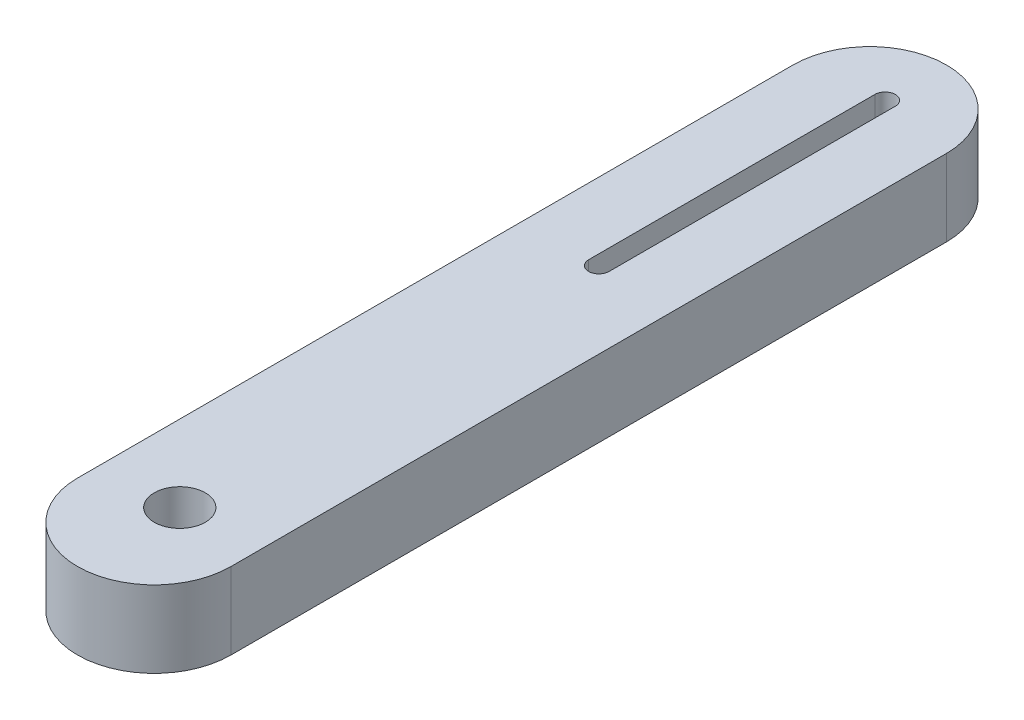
SolidWorks part; units mm, degrees
ref_plane "Front Plane" through (0, 0, 0) normal (0, 0, 1) x (1, 0, 0)
ref_plane "Top Plane" through (0, 0, 0) normal (0, 1, 0) x (1, 0, 0)
ref_plane "Right Plane" through (0, 0, 0) normal (1, 0, 0) x (0, 0, -1)
sketch "Sketch1" plane through (0, 0, 0) normal (0, 0, 1) x (1, 0, 0)
  line L1 (-19.05, -9.525) -> (-6.35, -9.525)
  line L2 (-19.05, -9.525) -> (-19.05, 9.525)
  line L3 (-19.05, 9.525) -> (19.05, 9.525)
  line L4 (19.05, -9.525) -> (19.05, 9.525)
  line L5 (-19.05, -9.525) -> (19.05, 9.525) construction
  line L6 (-19.05, 9.525) -> (19.05, -9.525) construction
  line L8 (0, 3.175) -> (0, -9.525) construction
  line L9 (6.35, -9.525) -> (19.05, -9.525)
  line L10 (-19.05, -9.525) -> (19.05, -9.525) construction
  line L11 (-6.35, -9.525) -> (-6.35, 3.175)
  line L12 (-6.35, 3.175) -> (6.35, 3.175)
  line L13 (6.35, -9.525) -> (6.35, 3.175)
  point P0 (0, 0)
  dimension "D1" = 19.05
  dimension "D2" = 38.1
  dimension "D3" = 12.7
  dimension "D4" = 12.7
extrude "Boss-Extrude1" add sketch "Sketch1" along normal blind 76.2
sketch "Sketch2" plane through (0, 0, 76.2) normal (0, 0, 1) x (1, 0, 0)
  line L1 (-19.05, 9.525) -> (19.05, 9.525)
  line L2 (-19.05, 9.525) -> (-19.05, -9.525)
  line L3 (-19.05, -9.525) -> (19.05, -9.525)
  line L4 (19.05, 9.525) -> (19.05, -9.525)
extrude "Boss-Extrude2" add sketch "Sketch2" along normal blind 127
sketch "Sketch3" plane through (0, 0, 0) normal (0, 0, -1) x (-1, 0, 0)
  line L1 (-19.05, 9.525) -> (19.05, 9.525)
  line L2 (-19.05, 9.525) -> (-19.05, -9.525)
  line L3 (-19.05, -9.525) -> (19.05, -9.525)
  line L4 (19.05, 9.525) -> (19.05, -9.525)
extrude "Boss-Extrude3" add sketch "Sketch3" along normal blind 12.7
sketch "Sketch4" plane through (0, 9.525, 0) normal (0, 1, 0) x (1, 0, 0)
  line L0 (0, -2.54) -> (0, -73.66) construction
  line L1 (2.54, -2.54) -> (2.54, -73.66)
  line L2 (-2.54, -2.54) -> (-2.54, -73.66)
  line L3 (-19.05, 0) -> (19.05, 0) construction
  line L4 (-19.05, 0) -> (19.05, 0) construction
  line L5 (-19.05, -203.2) -> (-19.05, 12.7) construction
  line L6 (19.05, -203.2) -> (19.05, 12.7) construction
  line L7 (19.05, -76.2) -> (-19.05, -76.2) construction
  line L8 (19.05, -203.2) -> (19.05, 12.7) construction
  line L9 (-19.05, -203.2) -> (-19.05, 12.7) construction
  line L11 (-6.35, -76.2) -> (6.35, -76.2) construction
  arc A0 (2.54, -2.54) -> (-2.54, -2.54) centre (0, -2.54) ccw
  arc A1 (-2.54, -73.66) -> (2.54, -73.66) centre (0, -73.66) ccw
  point P2 (0, -38.1)
  dimension "D2" = 5.08
extrude "Cut-Extrude1" cut sketch "Sketch4" along direction (0, 1, 0) on the side against the normal through all
sketch "Sketch5" plane through (0, 9.525, 0) normal (0, 1, 0) x (1, 0, 0)
  line L1 (0, -177.8) -> (0, -203.2) construction
  line L2 (19.05, -203.2) -> (-19.05, -203.2) construction
  circle A0 centre (0, -177.8) radius 6.35
  dimension "D1" = 12.7
  dimension "D2" = 25.4
extrude "Cut-Extrude2" cut sketch "Sketch5" against normal through all
sketch "Sketch6" plane through (0, 9.525, 0) normal (0, 1, 0) x (1, 0, 0)
  line L0 (0, -184.15) -> (0, -6.35) construction
  line L1 (-19.05, -184.15) -> (-19.05, -6.35)
  line L2 (19.05, -184.15) -> (19.05, -6.35)
  line L3 (-19.05, 12.7) -> (19.05, 12.7) construction
  line L4 (19.05, -203.2) -> (-19.05, -203.2) construction
  line L5 (-19.05, -203.2) -> (-19.05, 12.7) construction
  arc A0 (-19.05, -184.15) -> (19.05, -184.15) centre (0, -184.15) ccw
  arc A1 (19.05, -6.35) -> (-19.05, -6.35) centre (0, -6.35) ccw
  point P3 (0, -95.25)
extrude "Cut-Extrude3" cut sketch "Sketch6" against normal through all flip side to cut
